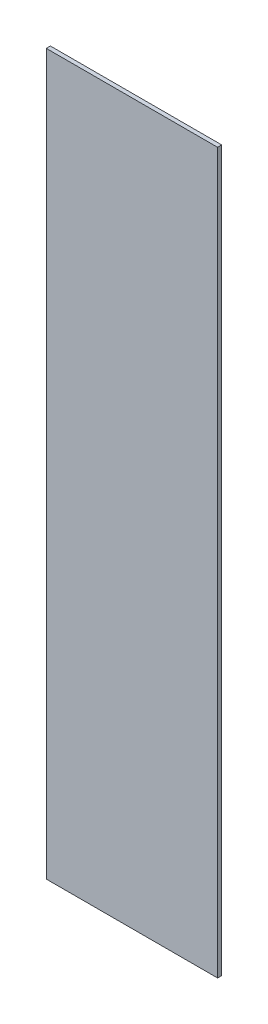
SolidWorks part; units mm, degrees
ref_plane "Plano frontal" through (0, 0, 0) normal (0, 0, 1) x (1, 0, 0)
ref_plane "Plano superior" through (0, 0, 0) normal (0, 1, 0) x (1, 0, 0)
ref_plane "Plano direito" through (0, 0, 0) normal (1, 0, 0) x (0, 0, -1)
sketch "Esboço1" plane through (0, 0, 0) normal (0, 0, 1) x (1, 0, 0)
  line L1 (0, 0) -> (250, 0)
  line L2 (0, 0) -> (0, 1050)
  line L3 (0, 1050) -> (250, 1050)
  line L4 (250, 0) -> (250, 1050)
  dimension "D1" = 1050
  dimension "D2" = 250
extrude "Ressalto-extrusão1" add sketch "Esboço1" along normal blind 6
